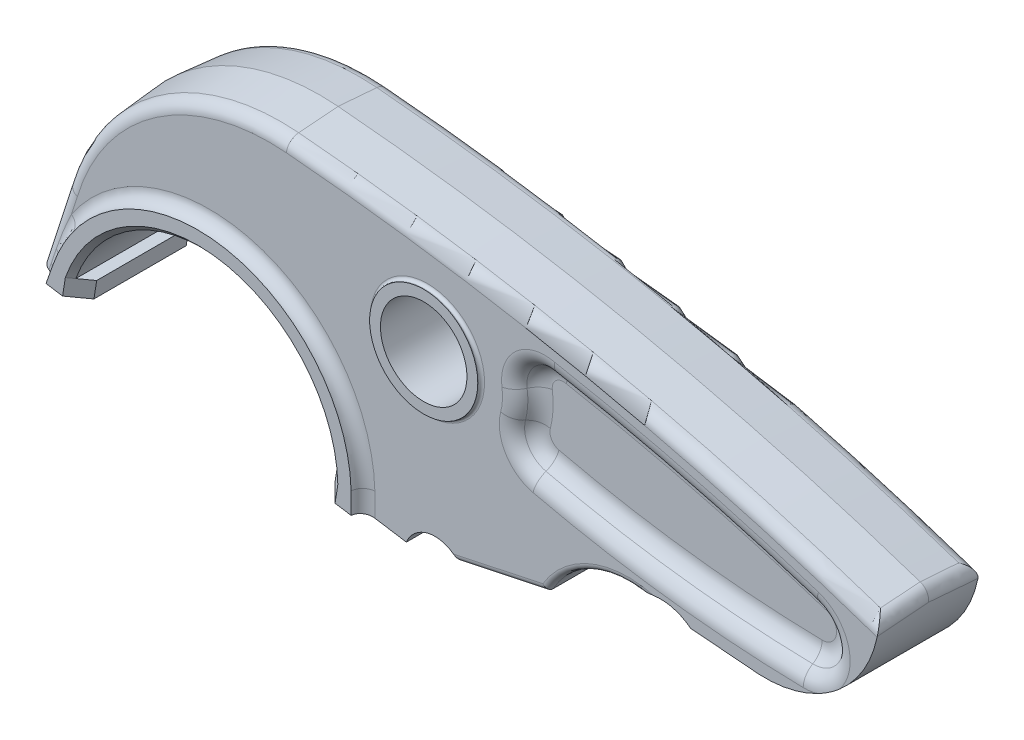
SolidWorks part; units mm, degrees
ref_plane "Plan de face" through (0, 0, 0) normal (0, 0, 1) x (1, 0, 0)
ref_plane "Plan de dessus" through (0, 0, 0) normal (0, 1, 0) x (1, 0, 0)
ref_plane "Plan de droite" through (0, 0, 0) normal (1, 0, 0) x (0, 0, -1)
sketch "Esquisse1" plane through (0, 0, 0) normal (0, 0, 1) x (1, 0, 0)
  line L2 (-119.6716, 27.7745) -> (-133.9114, 24.7477)
  line L3 (-142.4054, 23.4407) -> (-154.6312, 25.3771)
  line L4 (-154.6312, 25.3771) -> (-154.1854, 28.192)
  line L5 (-154.1854, 28.192) -> (-152.4965, 27.9245)
  line L6 (-96.3972, 34.359) -> (-85.4275, 33.4623)
  line L7 (-194.888, 34.6387) -> (-193.1991, 34.3712)
  line L8 (-193.1991, 34.3712) -> (-193.6449, 31.5562)
  line L9 (-193.6449, 31.5562) -> (-202.3048, 32.9278)
  line L11 (-202.3048, 32.9278) -> (-198.0649, 46.0133)
  arc A0 (-85.4275, 33.4623) -> (-65.8973, 50.7895) centre (-84.362, 51.9316) ccw
  arc A6 (-65.8973, 50.7895) -> (-161.6088, 70.8322) centre (-195.1228, -327.7614) ccw
  arc A8 (-152.4965, 27.9245) -> (-194.888, 34.6387) centre (-174.314, 27.3555) ccw
  arc A9 (-104.5283, 35.3663) -> (-119.6716, 27.7745) centre (-106.5517, 20.5034) ccw
  arc A10 (-96.3972, 34.359) -> (-104.5283, 35.3663) centre (-101.3076, 28.0433) ccw
  arc A11 (-133.9114, 24.7477) -> (-142.4054, 23.4407) centre (-137.7696, 21.5674) ccw
  arc A12 (-161.6088, 70.8322) -> (-198.0649, 46.0133) centre (-164.5412, 35.9552) ccw
  circle A13 centre (-139.0027, 52.1367) radius 7
extrude "Extrusion1" add sketch "Esquisse1" along normal blind 8.15
draft "Dépouille4" type of draft neutral plane draft angle 5 neutral plane "Plan de face" faces to draft 3 parameters "D1"=5
sketch "Esquisse2" plane through (0, 0, 8.15) normal (0, 0, 1) x (1, 0, 0)
  arc A0 (-124.2395, 48.5653) -> (-121.2248, 43.5541) centre (-120.2861, 47.5312) ccw
  arc A1 (-78.1496, 38.1635) -> (-76.6673, 46.929) centre (-78.1003, 42.6633) ccw
  arc A2 (-119.0351, 57.722) -> (-123.9713, 53.3273) centre (-120.0045, 53.8413) ccw
  arc A4 (-123.9713, 53.3273) -> (-124.2395, 48.5653) centre (-135.8765, 51.6092) cw
  arc A5 (-76.6673, 46.929) -> (-119.0351, 57.722) centre (-180.0588, -270.3787) ccw
  arc A6 (-78.1496, 38.1635) -> (-121.2248, 43.5541) centre (-74.3393, 243.4104) cw
extrude "Extrusion2" cut sketch "Esquisse2" against normal blind 3
fillet "Congé1" radius 3 6 edges at (-73.6633, 41.913, 8.15) (-99.8301, 39.717, 8.15) (-123.7877, 45.4247, 8.15) (-123.867, 50.9329, 8.15) (-97.6743, 53.0201, 8.15) (-122.6643, 56.8288, 8.15)
fillet "Congé2" radius 3 6 edges at (-122.6643, 56.8288, 5.15) (-97.6743, 53.0201, 5.15) (-73.6633, 41.913, 5.15) (-99.8301, 39.717, 5.15) (-123.7877, 45.4247, 5.15) (-123.867, 50.9329, 5.15)
fillet "Congé3" radius 2 4 edges at (-113.1963, 63.0303, 8.15) (-183.8396, 64.2955, 8.15) (-199.488, 39.308, 8.15)
fillet "Congé4" radius 1 2 edges at (-113.2742, 33.9127, 8.15) (-126.7915, 26.2611, 8.15)
sketch "Esquisse3" plane through (0, 0, 8.15) normal (0, 0, 1) x (1, 0, 0)
  circle A0 centre (-139.0027, 52.1367) radius 8.75
  circle A1 centre (-139.0027, 52.1367) radius 7
  dimension "D1" = 17.5
  dimension "D2" = 14
extrude "Extrusion3" add sketch "Esquisse3" along normal blind 0.6
fillet "Congé5" radius 0.5 1 edges at (-130.2527, 52.1367, 8.15)
sketch "Esquisse4" plane through (0, 0, 8.15) normal (0, 0, 1) x (1, 0, 0)
  line L0 (-197.716, 35.6398) -> (-198.8687, 32.3836)
  line L2 (-199.7594, 32.5247) -> (-193.6449, 31.5562) construction
  line L3 (-193.6449, 31.5562) -> (-193.1991, 34.3712)
  line L6 (-193.1991, 34.3712) -> (-194.888, 34.6387)
  line L7 (-149.4975, 28.0027) -> (-149.4975, 24.564)
  line L8 (-154.6312, 25.3771) -> (-142.4054, 23.4407) construction
  line L9 (-149.4975, 24.564) -> (-154.6312, 25.3771)
  line L10 (-154.6312, 25.3771) -> (-154.1854, 28.192)
  line L11 (-154.1854, 28.192) -> (-152.4965, 27.9245)
  line L12 (-198.8687, 32.3836) -> (-193.6449, 31.5562)
  arc A1 (-194.888, 34.6387) -> (-152.4965, 27.9245) centre (-174.314, 27.3555) cw
  arc A2 (-149.4975, 28.0027) -> (-197.716, 35.6398) centre (-174.314, 27.3555) ccw
  arc A3 (-149.4975, 28.0027) -> (-197.716, 35.6398) centre (-174.314, 27.3555) ccw
  dimension "D1" = 3
extrude "Extrusion4" add sketch "Esquisse4" along normal blind 1.85
fillet "Congé6" radius 2 3 edges at (-198.2923, 34.0117, 8.15) (-149.4975, 26.2834, 8.15) (-170.4306, 51.8749, 8.15)
chamfer "Chanfrein5" distance 0.85 angle 45 1 edges at (-170.8999, 48.9118, 10)
ref_plane "Plan1" through (0.5827, 3.6792, 0) normal (0.1564, 0.9877, 0) x (-0.9877, 0.1564, 0)
sketch "Esquisse5" plane through (0.5827, 3.6792, 0) normal (0.1564, 0.9877, 0) x (-0.9877, 0.1564, 0)
  line L4 (194.9109, 6.2018) -> (199.9289, 11.1391)
extrude "Extrusion5" cut sketch "Esquisse5" against normal through all
sketch "Esquisse6" plane through (0.5827, 3.6792, 0) normal (0.1564, 0.9877, 0) x (-0.9877, 0.1564, 0)
  line L0 (158.7476, 5.4627) -> (149.5751, 14.475)
extrude "Extrusion6" cut sketch "Esquisse6" against normal through all flip side to cut
mirror "Symétrie5" about plane through (0, 0, 0) normal (0, 0, 1) of "Congé4", "Congé3", "Congé6", "Extrusion1", "Dépouille4", "Extrusion2", "Extrusion3", "Extrusion4", "Chanfrein5", "Extrusion5", "Extrusion6", "Congé5"
fillet "Congé8" radius 3 6 edges at (-123.7877, 45.4247, -5.15) (-99.8301, 39.717, -5.15) (-73.6633, 41.913, -5.15) (-97.6743, 53.0201, -5.15) (-122.6643, 56.8288, -5.15) (-123.867, 50.9329, -5.15)
fillet "Congé9" radius 3 6 edges at (-122.6643, 56.8288, -8.15) (-123.867, 50.9329, -8.15) (-123.7877, 45.4247, -8.15) (-99.8301, 39.717, -8.15) (-73.6633, 41.913, -8.15) (-97.6743, 53.0201, -8.15)
